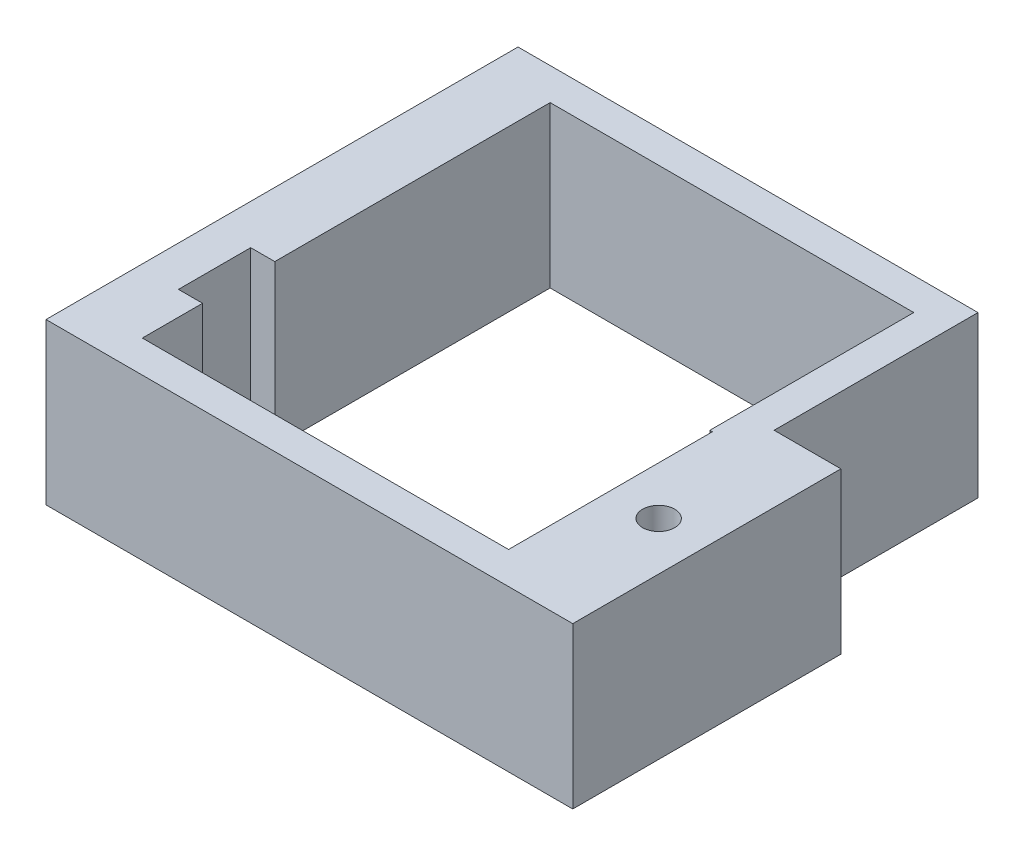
SolidWorks part; units mm, degrees
ref_plane "Front Plane" through (0, 0, 0) normal (0, 0, 1) x (1, 0, 0)
ref_plane "Top Plane" through (0, 0, 0) normal (0, 1, 0) x (1, 0, 0)
ref_plane "Right Plane" through (0, 0, 0) normal (1, 0, 0) x (0, 0, -1)
sketch "Sketch1" plane through (0, 0, 0) normal (0, 1, 0) x (1, 0, 0)
  line L0 (0, 0) -> (0, 29.4)
  line L1 (0, 29.4) -> (28.65, 29.4)
  line L2 (28.65, 29.4) -> (28.65, 16.7)
  line L3 (28.65, 16.7) -> (32.81, 16.7)
  line L4 (32.81, 16.7) -> (32.81, 0)
  line L5 (32.81, 0) -> (0, 0)
  line L6 (26.81, 6.7391) -> (26.81, 14.7)
  line L7 (26.81, 14.7) -> (26.65, 14.7)
  line L8 (26.65, 14.7) -> (26.65, 27.4)
  line L9 (26.65, 27.4) -> (4, 27.4)
  line L10 (4, 27.4) -> (4, 2)
  line L11 (4, 2) -> (26.81, 2)
  line L12 (26.81, 2) -> (26.81, 6.7391)
  dimension "D1" = 12.7
  dimension "D2" = 4
  dimension "D3" = 22.65
  dimension "D4" = 29.4
  dimension "D5" = 6
  dimension "D6" = 2
  dimension "D7" = 2
  dimension "D8" = 2
  dimension "D9" = 2
  dimension "D10" = 32.81
extrude "Boss-Extrude1" add sketch "Sketch1" along normal blind 10
sketch "Sketch2" plane through (0, 10, 0) normal (0, 1, 0) x (1, 0, 0)
  line L0 (26.81, 14.7) -> (32.81, 14.7)
  line L1 (32.81, 0) -> (32.81, 16.7) construction
  line L2 (32.81, 14.7) -> (32.81, 2)
  line L3 (32.81, 2) -> (26.81, 2)
  line L4 (26.81, 2) -> (26.81, 14.7)
  line L5 (26.81, 14.7) -> (32.81, 2)
  line L6 (32.81, 14.7) -> (26.81, 2)
  circle A0 centre (29.81, 8.35) radius 1
  dimension "D1" = 2
extrude "Cut-Extrude1" cut sketch "Sketch2" against normal through all contours L5 A0 L6 | L6 A0 L5 | L5 A0 L6 | L6 A0 L5
sketch "Sketch3" plane through (0, 10, 0) normal (0, 1, 0) x (1, 0, 0)
  line L0 (4, 5.75) -> (2.5, 5.75)
  line L7 (0, 29.4) -> (0, 0) construction
  line L8 (2.5, 10.25) -> (2.5, 5.75)
  line L9 (0, 5.75) -> (0, 10.25)
  line L10 (4, 5.75) -> (4, 10.25)
  line L11 (4, 27.4) -> (4, 2) construction
  line L12 (-1.5, 10.25) -> (-1.5, 5.75)
  line L14 (4, 10.25) -> (2.5, 10.25)
  line L15 (0, 10.25) -> (-1.5, 10.25)
  line L16 (0, 5.75) -> (-1.5, 5.75)
  point P0 (29.81, 8.35)
  dimension "D2" = 1.5
  dimension "D3" = 1.5
  dimension "D4" = 1.5
  dimension "D5" = 1.5
extrude "Cut-Extrude2" cut sketch "Sketch3" against normal through all
